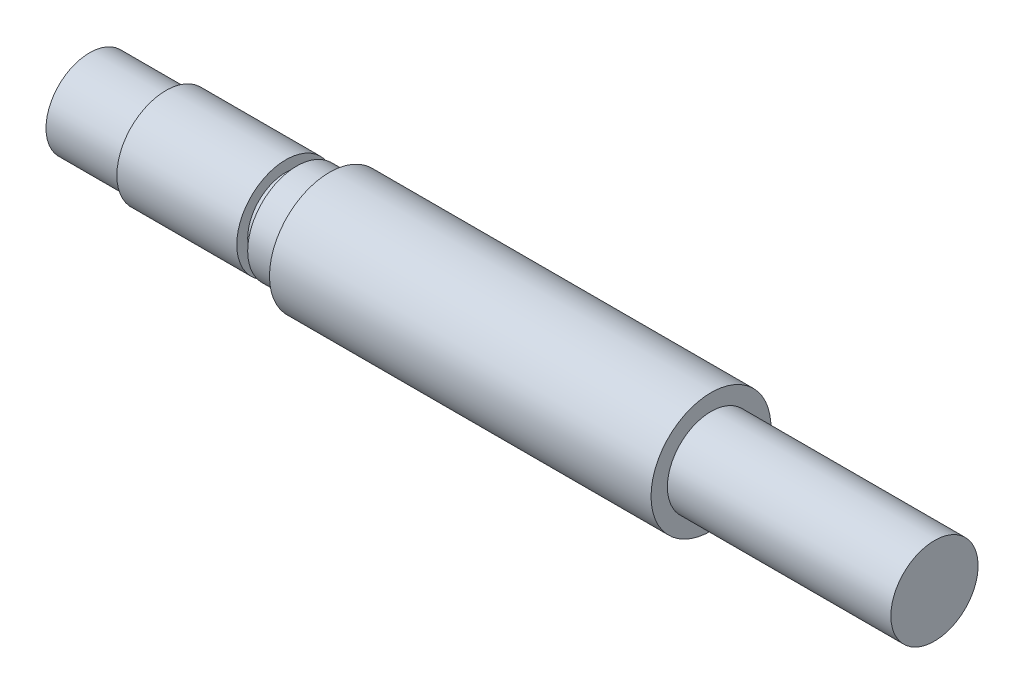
SolidWorks part; units mm, degrees
ref_plane "Face" through (0, 0, 0) normal (0, 0, 1) x (1, 0, 0)
ref_plane "Dessus" through (0, 0, 0) normal (0, 1, 0) x (1, 0, 0)
ref_plane "Droite" through (0, 0, 0) normal (1, 0, 0) x (0, 0, -1)
sketch "Esquisse1" plane through (0, 0, 0) normal (0, 0, 1) x (1, 0, 0)
  line L0 (0, 0) -> (150.99, 0) construction
  line L1 (0, 0) -> (0, 4)
  line L2 (7, 4.5) -> (18, 4.5)
  line L3 (18, 4.5) -> (18, 3.5)
  line L4 (18, 3.5) -> (19, 3.5)
  line L5 (19, 3.5) -> (19, 4.5)
  line L6 (19, 4.5) -> (22, 4.5)
  line L7 (22, 4.5) -> (22, 5.5)
  line L8 (22, 5.5) -> (57, 5.5)
  line L9 (57, 5.5) -> (57, 4)
  line L10 (57, 4) -> (77.5, 4)
  line L11 (77.5, 4) -> (77.5, 0)
  line L12 (77.5, 0) -> (0, 0)
  line L13 (0, 4) -> (7, 4)
  line L14 (7, 4) -> (7, 4.5)
  dimension "D1" = 4.5
  dimension "D2" = 5.5
  dimension "D3" = 1
  dimension "D4" = 1
  dimension "D5" = 3
  dimension "D6" = 18
  dimension "D7" = 35
  dimension "D8" = 20.5
  dimension "D9" = 7
  dimension "D10" = 4
revolve "Révolution1" add sketch "Esquisse1" angle 360 about L0
